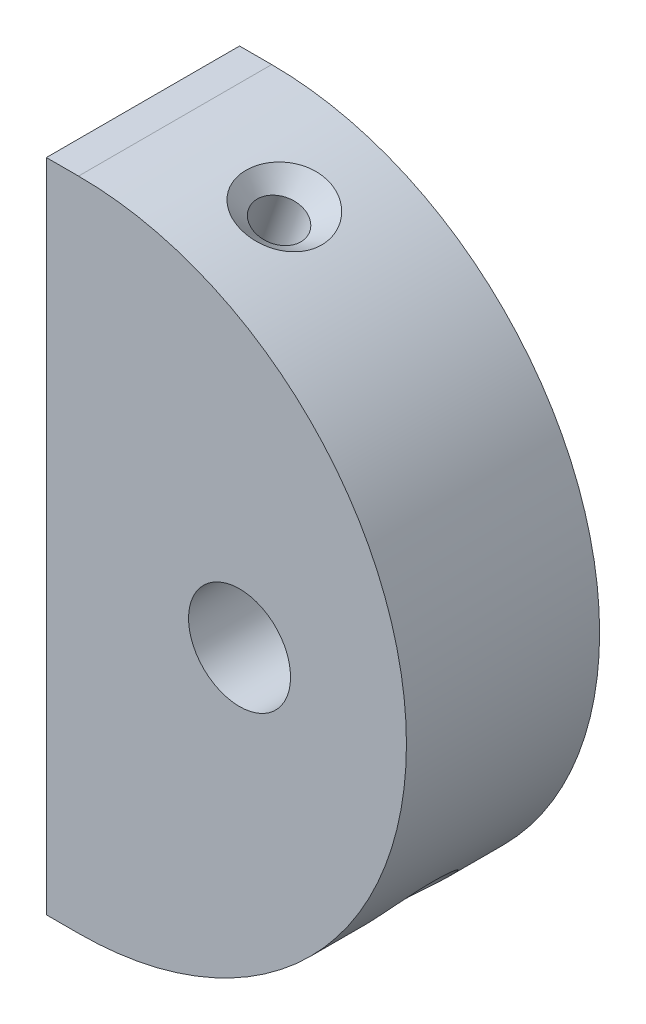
SolidWorks part; units mm, degrees
ref_plane "Plane1" through (0, 0, 0) normal (0, 0, 1) x (1, 0, 0)
ref_plane "Plane2" through (0, 0, 0) normal (0, 1, 0) x (1, 0, 0)
ref_plane "Plane3" through (0, 0, 0) normal (1, 0, 0) x (0, 0, -1)
sketch "Sketch1" plane through (0, 0, 0) normal (0, 0, 1) x (1, 0, 0)
  line L0 (0, 0) -> (15.875, 0) construction
  line L1 (0, 26.9494) -> (2.6416, 26.9494)
  line L2 (0, 26.9494) -> (0, -26.9494)
  line L3 (0, -26.9494) -> (2.6416, -26.9494)
  line L4 (29.591, -27.94) -> (29.591, 27.94) construction
  line L5 (0, 19.8374) -> (19.05, 19.8374) construction
  line L7 (19.05, 11.9126) -> (0, 11.9126) construction
  line L8 (19.05, 11.9126) -> (19.05, 19.8374) construction
  line L9 (0, -11.9126) -> (19.05, -11.9126) construction
  line L11 (19.05, -19.8374) -> (0, -19.8374) construction
  line L12 (19.05, -19.8374) -> (19.05, -11.9126) construction
  circle A0 centre (15.875, 0) radius 4.191
  circle A1 centre (15.0876, 15.875) radius 3.9624 construction
  circle A2 centre (15.0876, -15.875) radius 3.9624 construction
  arc A3 (2.6416, 26.9494) -> (2.6416, -26.9494) centre (2.6416, 0) cw
  dimension "D3" = 7.9248
  dimension "D4" = 8.382
  dimension "D7" = 26.9494
  dimension "D1" = 31.75
  dimension "D2" = 19.05
  dimension "D5" = 15.875
  dimension "D6" = 29.591
  dimension "D9" = 9.525
extrude "Base-Extrude" add sketch "Sketch1" along normal mid plane 15.875
hole_wizard "CSK for #6 Flat Head Machine Screw (100)1" positions "3DSketch1" profile "Sketch2" countersink size "#6" standard "Ansi Inch"
sketch3d "3DSketch1"
  point P0 (11.6477, 25.4, 0)
  point P1 (21.7038, -19.05, 0)
  dimension "D1" = 19.05
  dimension "D2" = 25.4
sketch "Sketch2" plane through (11.6477, 25.4, 0) normal (0, 0, 1) x (-0.9425, 0.3342, 0)
  line L0 (0, 0) -> (0, 13.8408)
  line L1 (0, 13.8408) -> (1.8986, 12.7)
  line L2 (1.8986, 12.7) -> (1.8986, 1.38)
  line L3 (1.8986, 1.38) -> (3.5433, 0)
  line L5 (3.5433, 0) -> (0, 0)
  line L6 (-1.8986, 1.38) -> (-3.5433, 0) construction
  line L10 (0, 13.8408) -> (-1.8986, 12.7) construction
  line L11 (0, -6.35) -> (0, 107.95) construction
  dimension "Hole Dia." = 3.7973
  dimension "Hole Depth" = 12.7
  dimension "Near C'Sink Dia." = 7.0866
  dimension "Near C'Sink Angle" = 100
  dimension "Drill Angle" = 118
